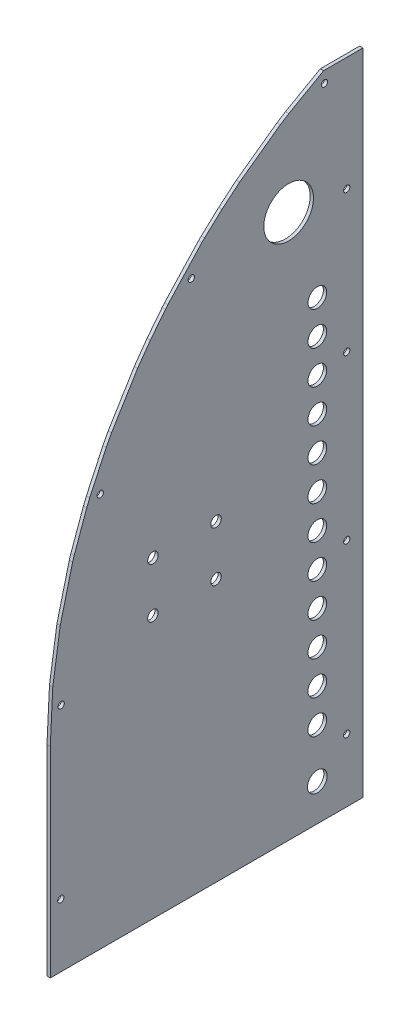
SolidWorks part; units mm, degrees
ref_plane "Front Plane" through (0, 0, 0) normal (0, 0, 1) x (1, 0, 0)
ref_plane "Top Plane" through (0, 0, 0) normal (0, 1, 0) x (1, 0, 0)
ref_plane "Right Plane" through (0, 0, 0) normal (1, 0, 0) x (0, 0, -1)
imported_body "Imported3"
sketch "Sketch24" plane through (907.5363, 0, 0) normal (1, 0, 0) x (0, 0, -1)
  line L4 (-766.2647, 1048.4829) -> (-767.8712, 1048.4829)
  line L43 (-853.0265, 1006.6617) -> (-863.5566, 996.9724)
  line L44 (-863.5566, 996.9724) -> (-865.1657, 995.4091)
  line L45 (-865.1657, 995.4091) -> (-885.7523, 973.1495)
  line L46 (-885.7523, 973.1495) -> (-887.2237, 971.377)
  line L47 (-887.2237, 971.377) -> (-896.3096, 959.7875)
  line L48 (-896.3096, 959.7875) -> (-904.0256, 948.9546)
  line L49 (-904.0256, 948.9546) -> (-919.8046, 923.064)
  line L50 (-919.8046, 923.064) -> (-922.9859, 917.0477)
  line L51 (-922.9859, 917.0477) -> (-932.9332, 895.7338)
  line L52 (-932.9332, 895.7338) -> (-934.7132, 891.4084)
  line L53 (-934.7132, 891.4084) -> (-942.3243, 870.2883)
  line L54 (-942.3243, 870.2883) -> (-943.2817, 867.2344)
  line L55 (-943.2817, 867.2344) -> (-950.7474, 837.8479)
  line L56 (-950.7474, 837.8479) -> (-955.2566, 807.8651)
  line L57 (-955.2566, 807.8651) -> (-956.7646, 777.5826)
  line L58 (-956.7646, 777.5826) -> (-956.7646, 357.4852)
  line L59 (-956.7646, 357.4852) -> (-955.2566, 327.2027)
  line L60 (-955.2566, 327.2027) -> (-950.7474, 297.2199)
  line L61 (-950.7474, 297.2199) -> (-943.2817, 267.8334)
  line L62 (-943.2817, 267.8334) -> (-942.3243, 264.7796)
  line L63 (-942.3243, 264.7796) -> (-934.7132, 243.6594)
  line L64 (-934.7132, 243.6594) -> (-932.9332, 239.3341)
  line L65 (-932.9332, 239.3341) -> (-919.8046, 212.0039)
  line L66 (-919.8046, 212.0039) -> (-914.9366, 203.3787)
  line L67 (-914.9366, 203.3787) -> (-904.0256, 186.1132)
  line L68 (-904.0256, 186.1132) -> (-896.3096, 175.2803)
  line L69 (-896.3096, 175.2803) -> (-887.2237, 163.6908)
  line L70 (-887.2237, 163.6908) -> (-885.7523, 161.9184)
  line L71 (-885.7523, 161.9184) -> (-865.1657, 139.6587)
  line L72 (-865.1657, 139.6587) -> (-863.5566, 138.0954)
  line L73 (-863.5566, 138.0954) -> (-853.0265, 128.4062)
  line L74 (-853.0265, 128.4062) -> (-842.4693, 119.5545)
  line L75 (-842.4693, 119.5545) -> (-817.888, 101.8047)
  line L76 (-817.888, 101.8047) -> (-812.6938, 98.508)
  line L77 (-812.6938, 98.508) -> (-796.6892, 89.2356)
  line L78 (-796.6892, 89.2356) -> (-791.6647, 86.5849)
  line L79 (-791.6647, 86.5849) -> (-767.8712, 86.5849)
  line L80 (-767.8712, 86.5849) -> (-767.8712, 1048.4829)
  line L81 (-767.8712, 1048.4829) -> (-791.6647, 1048.4829)
  line L82 (-791.6647, 1048.4829) -> (-812.6938, 1036.5598)
  line L83 (-812.6938, 1036.5598) -> (-817.888, 1033.2631)
  line L84 (-817.888, 1033.2631) -> (-842.4693, 1015.5133)
  line L85 (-842.4693, 1015.5133) -> (-853.0265, 1006.6617)
  line L86 (-853.0265, 1006.6617) -> (-863.5566, 996.9724)
  line L87 (-863.5566, 996.9724) -> (-865.1657, 995.4091)
  line L88 (-865.1657, 995.4091) -> (-885.7523, 973.1495)
  line L89 (-885.7523, 973.1495) -> (-887.2237, 971.377)
  line L90 (-887.2237, 971.377) -> (-896.3096, 959.7875)
  line L91 (-896.3096, 959.7875) -> (-904.0256, 948.9546)
  line L92 (-904.0256, 948.9546) -> (-919.8046, 923.064)
  line L93 (-919.8046, 923.064) -> (-922.9859, 917.0477)
  line L94 (-922.9859, 917.0477) -> (-932.9332, 895.7338)
  line L95 (-932.9332, 895.7338) -> (-934.7132, 891.4084)
  line L96 (-934.7132, 891.4084) -> (-942.3243, 870.2883)
  line L97 (-942.3243, 870.2883) -> (-943.2817, 867.2344)
  line L98 (-943.2817, 867.2344) -> (-950.7474, 837.8479)
  line L99 (-950.7474, 837.8479) -> (-955.2566, 807.8651)
  line L100 (-955.2566, 807.8651) -> (-956.7646, 777.5826)
  line L101 (-956.7646, 777.5826) -> (-956.7646, 656.4339)
  line L124 (-767.8712, 1048.4829) -> (-791.6647, 1048.4829)
  line L125 (-791.6647, 1048.4829) -> (-812.6938, 1036.5598)
  line L126 (-812.6938, 1036.5598) -> (-817.888, 1033.2631)
  line L127 (-817.888, 1033.2631) -> (-842.4693, 1015.5133)
  line L128 (-842.4693, 1015.5133) -> (-853.0265, 1006.6617)
  line L148 (-956.7646, 656.4339) -> (-766.2647, 656.4339)
  line L155 (-766.2647, 656.4339) -> (-766.2647, 1048.4829)
  circle A25 centre (-795.4902, 708.1864) radius 5.6515
  circle A26 centre (-795.4866, 728.5064) radius 5.6515
  circle A27 centre (-795.4829, 748.8264) radius 5.6515
  circle A28 centre (-795.4793, 769.1464) radius 5.6515
  circle A29 centre (-795.4756, 789.4664) radius 5.6515
  circle A30 centre (-795.472, 809.7864) radius 5.6515
  circle A31 centre (-795.4683, 830.1064) radius 5.6515
  circle A32 centre (-795.4647, 850.4264) radius 5.6515
  circle A33 centre (-795.461, 870.7464) radius 5.6515
  circle A34 centre (-795.4574, 891.0664) radius 5.6515
  circle A35 centre (-795.4537, 911.3864) radius 5.6515
  circle A36 centre (-795.4501, 931.7064) radius 5.6515
  circle A37 centre (-812.798, 984.9939) radius 14.986
  circle A40 centre (-894.762, 815.0188) radius 3.175
  circle A41 centre (-894.762, 845.194) radius 3.175
  circle A42 centre (-856.662, 815.0188) radius 3.175
  circle A43 centre (-856.662, 845.194) radius 3.175
  circle A44 centre (-795.4902, 678.5909) radius 5.9531
  circle A54 centre (-950.4147, 694.5339) radius 1.905
  circle A55 centre (-950.1864, 795.8924) radius 1.905
  circle A56 centre (-926.5852, 894.4413) radius 1.905
  circle A57 centre (-871.557, 979.7004) radius 1.905
  circle A58 centre (-791.143, 1041.5936) radius 1.905
  circle A65 centre (-777.7175, 694.5339) radius 1.905
  circle A66 centre (-777.7175, 795.8924) radius 1.905
  circle A67 centre (-777.7175, 979.7004) radius 1.905
  circle A68 centre (-777.7175, 894.4413) radius 1.905
  point P207 (-950.4147, 694.5339)
  point P210 (-950.1864, 795.8924)
  point P223 (-926.5852, 894.4413)
  point P229 (-871.557, 979.7004)
  point P235 (-791.143, 1041.5936)
  dimension "D2" = 190.5
  dimension "D6" = 20.32
  dimension "D44" = 6.35
  dimension "D45" = 11.303
  dimension "D47" = 29.972
  dimension "D48" = 11.9063
  dimension "D4" = 392.049
  dimension "D42" = 38.1
  dimension "D43" = 30.1752
  dimension "D1" = 0
extrude "Boss-Extrude1" add sketch "Sketch24" along normal blind 2 separate body contours L148 A68 A67 A66 A65 A58 A57 A56 A55 A54 A44 A43 A42 A41 A40 M277 M299 M300 M301 M302 M303 M304 M262 M263 M264 M265 M266 M267 M268 M269 M270 M271 M272 M273 M274 M275 M276
